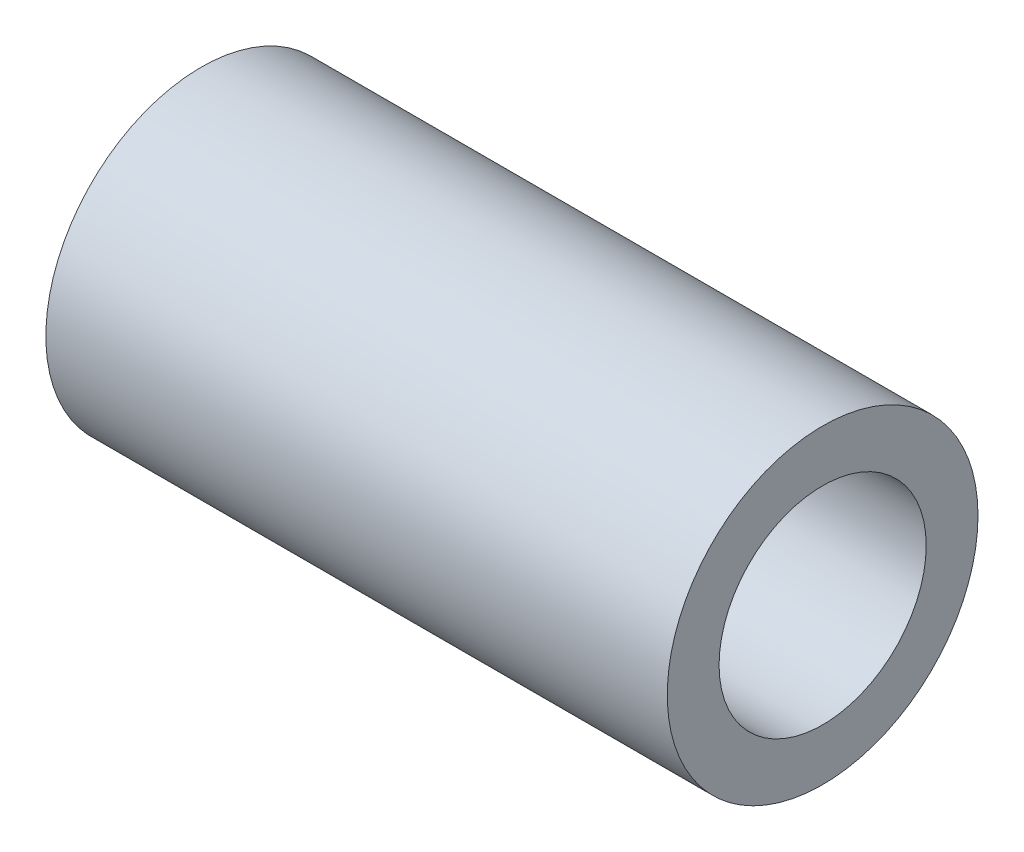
SolidWorks part; units mm, degrees
ref_plane "Front Plane" through (0, 0, 0) normal (0, 0, 1) x (1, 0, 0)
ref_plane "Top Plane" through (0, 0, 0) normal (0, 1, 0) x (1, 0, 0)
ref_plane "Right Plane" through (0, 0, 0) normal (1, 0, 0) x (0, 0, -1)
sketch "Sketch1" plane through (0, 0, 0) normal (1, 0, 0) x (0, 0, -1)
  circle A0 centre (0, 0) radius 2
  circle A1 centre (0, 0) radius 3
  dimension "D1" = 4
  dimension "D2" = 6
extrude "Boss-Extrude1" add sketch "Sketch1" along normal blind 12
